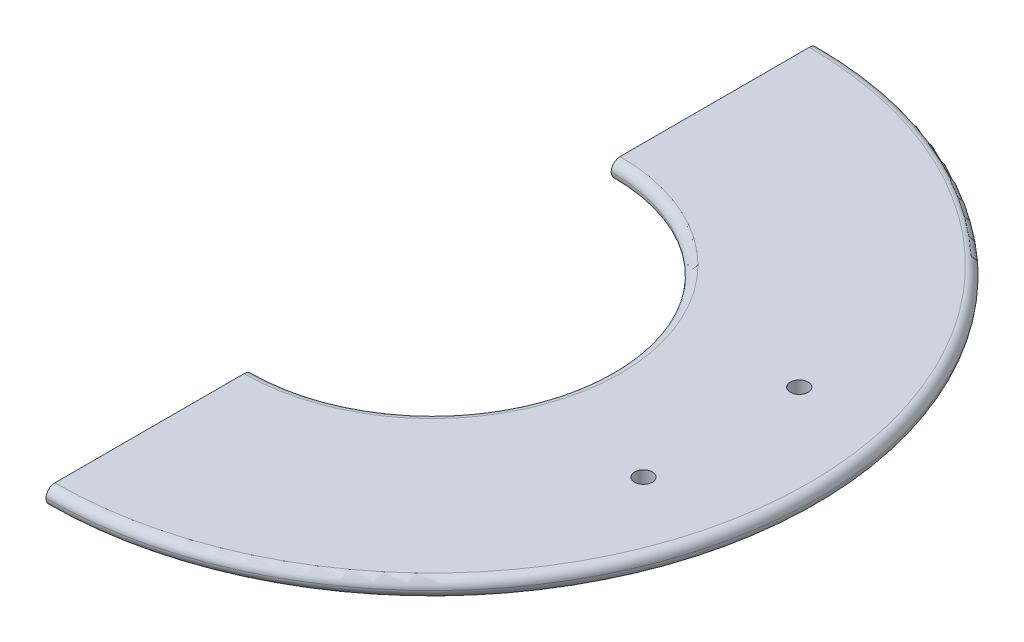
SolidWorks part; units mm, degrees
ref_plane "Front Plane" through (0, 0, 0) normal (0, 0, 1) x (1, 0, 0)
ref_plane "Top Plane" through (0, 0, 0) normal (0, 1, 0) x (1, 0, 0)
ref_plane "Right Plane" through (0, 0, 0) normal (1, 0, 0) x (0, 0, -1)
sketch "Sketch1" plane through (0, 0, 0) normal (0, 1, 0) x (1, 0, 0)
  line L0 (0, 86.75) -> (0, 40.25)
  line L1 (0, -40.25) -> (0, -86.75)
  arc A0 (0, 40.25) -> (0, -40.25) centre (0, 0) ccw
  arc A1 (0, 86.75) -> (0, -86.75) centre (0, 0) ccw
  dimension "D1" = 173.5
  dimension "D2" = 80.5
extrude "Boss-Extrude1" add sketch "Sketch1" along normal blind 4
sketch "Sketch2" plane through (0, 0, 0) normal (0, -1, 0) x (1, 0, 0)
  line L1 (-2.5, -83.75) -> (-14.5, -83.75)
  line L2 (-2.5, -83.75) -> (-2.5, -73.75)
  line L3 (-2.5, -73.75) -> (-14.5, -73.75)
  line L4 (-14.5, -83.75) -> (-14.5, -73.75)
  line L5 (0, -40.25) -> (0, -86.75) construction
  dimension "D1" = 12
  dimension "D2" = 10
  dimension "D3" = 3
  dimension "D4" = 2.5
extrude "Boss-Extrude2" add sketch "Sketch2" along normal blind 5
sketch "Sketch3" plane through (0, 0, -83.75) normal (0, 0, -1) x (-1, 0, 0)
  line L1 (2.5, -5) -> (14.5, -5)
  line L2 (2.5, -5) -> (2.5, -1.5)
  line L3 (2.5, -1.5) -> (14.5, -1.5)
  line L4 (14.5, -5) -> (14.5, -1.5)
  line L5 (14.5, -5) -> (14.5, 0) construction
  dimension "D1" = 3.5
extrude "Boss-Extrude3" add sketch "Sketch3" along normal blind 5
fillet "Fillet1" radius 1 9 edges at (-14.5, -5, -81.25) (-2.5, -5, -81.25) (-2.5, -1.5, -86.25) (-14.5, -1.5, -86.25) (-8.5, -5, -73.75) (-8.5, -5, -88.75) (-8.5, -1.5, -88.75) (-14.5, -3.25, -88.75) (-2.5, -3.25, -88.75)
fillet "Fillet2" radius 2 4 edges at (-86.75, 4, 0) (-40.25, 0, 0) (-86.75, 0, 0) (-40.25, 4, 0)
sketch "Sketch4" plane through (0, 4, 0) normal (0, 1, 0) x (1, 0, 0)
  line L0 (0, 0) -> (-65, 0) construction
  line L1 (-65, -17.5) -> (-65, 17.5) construction
  circle A0 centre (-65, -17.5) radius 2
  circle A1 centre (-65, 17.5) radius 2
  point P5 (-65, 0)
  dimension "D1" = 35
  dimension "D2" = 65
hole_wizard "Ø4.0mm Dowel Hole1" positions "3DSketch1" profile "Sketch5" hole size "Ø4.0" standard "ANSI Metric"
sketch3d "3DSketch1"
  point P0 (-65, 4, 17.5)
  point P3 (-65, 4, -17.5)
sketch "Sketch5" plane through (-65, 4, 17.5) normal (1, 0, 0) x (0, 0, 1)
  line L0 (0, 0) -> (0, 9)
  line L1 (0, 9) -> (2, 9)
  line L2 (2, 9) -> (2, 0)
  line L5 (2, 0) -> (0, 0)
  line L11 (0, -6.35) -> (0, 107.95) construction
  dimension "Thru Hole Dia." = 4
  dimension "Thru Hole Depth" = 9
ref_plane "Plane1" through (0, 0, 0) normal (1, 0, 0) x (0, 0, -1)
mirror "Mirror1" about plane through (0, 0, 0) normal (1, 0, 0)
sketch "Sketch6" plane through (0, 0, 0) normal (1, 0, 0) x (0, 0, -1)
  line L1 (100.5733, 37.6973) -> (-96.1419, 37.6973)
  line L2 (100.5733, 37.6973) -> (100.5733, -33.7938)
  line L3 (100.5733, -33.7938) -> (-96.1419, -33.7938)
  line L4 (-96.1419, 37.6973) -> (-96.1419, -33.7938)
extrude "Cut-Extrude1" cut sketch "Sketch6" against normal up to next
